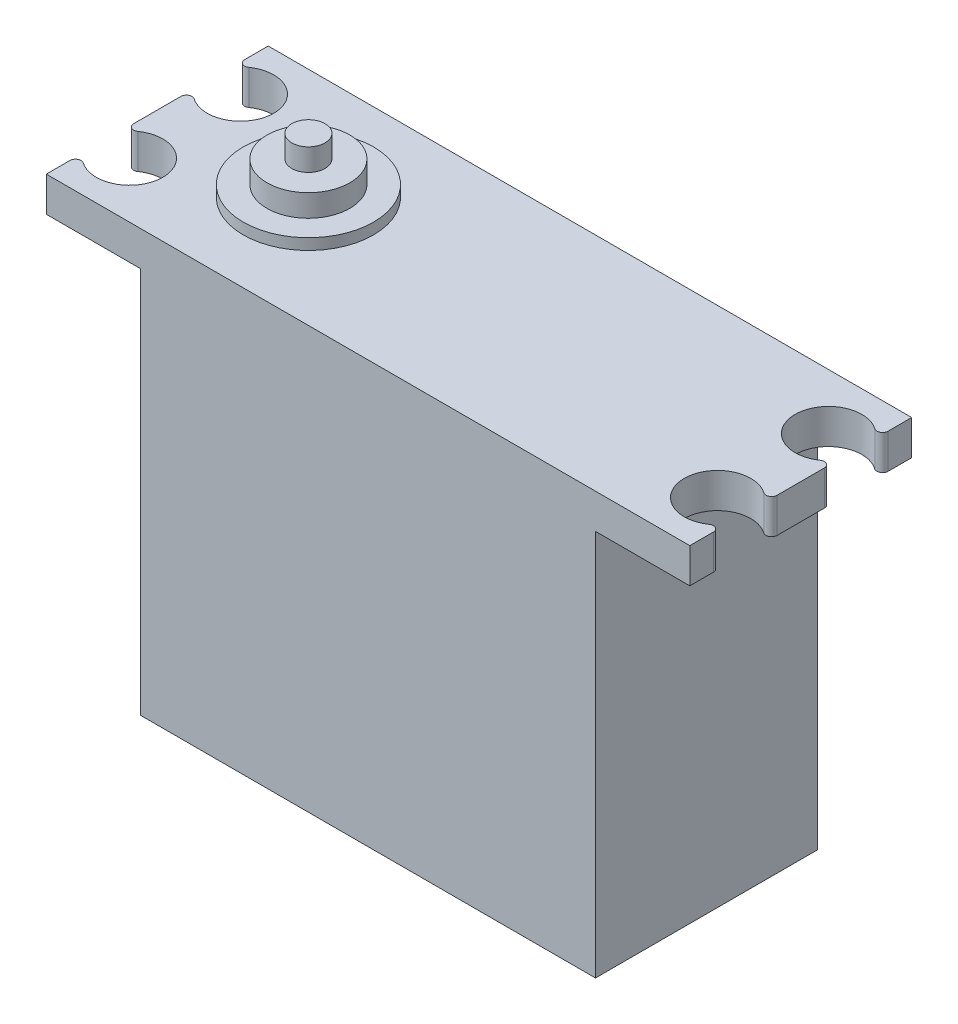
SolidWorks part; units mm, degrees
ref_plane "Front Plane" through (0, 0, 0) normal (0, 0, 1) x (1, 0, 0)
ref_plane "Top Plane" through (0, 0, 0) normal (0, 1, 0) x (1, 0, 0)
ref_plane "Right Plane" through (0, 0, 0) normal (1, 0, 0) x (0, 0, -1)
sketch "Sketch1" plane through (0, 0, 0) normal (0, 0, 1) x (1, 0, 0)
  line L0 (-29, 19) -> (29, 19)
  line L1 (20.5, -19) -> (-20.5, -19)
  line L2 (20.5, -19) -> (20.5, 15.8627)
  line L3 (20.5, 19) -> (-20.5, 19)
  line L4 (-20.5, -19) -> (-20.5, 15.8627)
  line L7 (-20.5, 15.8627) -> (-29, 15.8627)
  line L8 (29, 19) -> (29, 15.8627)
  line L9 (29, 15.8627) -> (20.5, 15.8627)
  line L10 (-29, 19) -> (-29, 15.8627)
  point P0 (0, 0)
  point P6 (0, 19)
  dimension "D1" = 41
  dimension "D2" = 38
extrude "Boss-Extrude1" add sketch "Sketch1" against normal blind 20 contours L0 L8 L9 L2 L1 L4 L7 L10
sketch "Sketch2" plane through (0, 19, 0) normal (0, 1, 0) x (1, 0, 0)
  line L0 (-29, 10) -> (31.146, 10) construction
  line L1 (-29, 20) -> (-29, 0) construction
  line L2 (0, 0) -> (0, 20) construction
  line L3 (-29, 0) -> (29, 0) construction
  line L4 (-29, 20) -> (29, 20) construction
  line L5 (29, 20) -> (29, 0) construction
  circle A0 centre (26.5, 5) radius 3
  circle A1 centre (26.5, 15) radius 3
  circle A2 centre (-26.5, 5) radius 3
  circle A3 centre (-26.5, 15) radius 3
  dimension "D1" = 6
  dimension "D2" = 2.5
  dimension "D3" = 10
extrude "Cut-Extrude2" cut sketch "Sketch2" against normal through all
fillet "Fillet1" radius 0.5 8 edges at (-29, 17.4314, -13.3417) (-29, 17.4314, -16.6583) (-29, 17.4314, -3.3417) (-29, 17.4314, -6.6583) (29, 17.4314, -16.6583) (29, 17.4314, -13.3417) (29, 17.4314, -6.6583) (29, 17.4314, -3.3417)
sketch "Sketch4" plane through (0, 19, 0) normal (0, 1, 0) x (1, 0, 0)
  line L0 (-29, 10) -> (29, 10) construction
  line L1 (-29, 12.1277) -> (-29, 7.8723) construction
  line L2 (29, 12.1277) -> (29, 7.8723) construction
  circle A0 centre (-15.3758, 10) radius 5.8721
extrude "Boss-Extrude2" add sketch "Sketch4" along normal blind 1
sketch "Sketch5" plane through (0, 20, 0) normal (0, 1, 0) x (1, 0, 0)
  circle A0 centre (-15.3758, 10) radius 3.7328
extrude "Boss-Extrude3" add sketch "Sketch5" along normal blind 2
sketch "Sketch8" plane through (0, 22, 0) normal (0, 1, 0) x (1, 0, 0)
  circle A0 centre (-15.3758, 10) radius 1.5
  dimension "D1" = 3
extrude "Boss-Extrude4" add sketch "Sketch8" along normal blind 2
